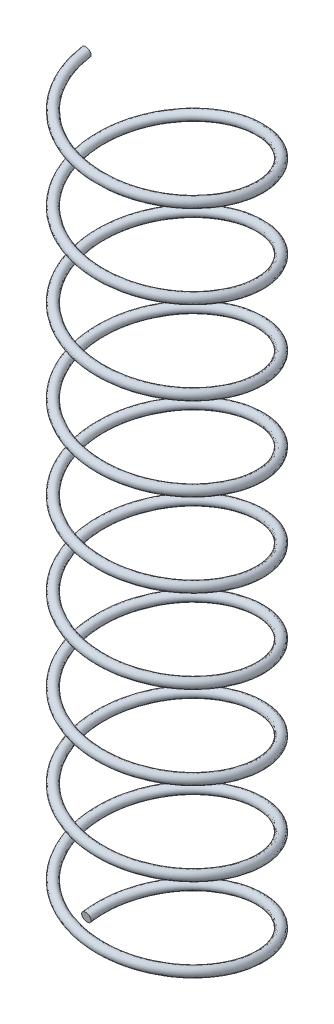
SolidWorks part; units mm, degrees
ref_plane "Face" through (0, 0, 0) normal (0, 0, 1) x (1, 0, 0)
ref_plane "Dessus" through (0, 0, 0) normal (0, 1, 0) x (1, 0, 0)
ref_plane "Droite" through (0, 0, 0) normal (1, 0, 0) x (0, 0, -1)
sketch "Esquisse2" plane through (0, 0, 0) normal (0, 1, 0) x (1, 0, 0)
  circle A0 centre (-1.9759, 0) radius 4.25
curve "Hélice2"
ref_plane "Plan1" through (-6.2259, 40, 0) normal (0, 0.1642, -0.9864) x (-1, 0, 0)
sketch "Esquisse3" plane through (-6.2259, 40, 0) normal (0, 0.1642, -0.9864) x (-1, 0, 0)
  circle A0 centre (0.0548, -0.0305) radius 0.25
sweep "Base-Balayage" add profiles "Esquisse3" path "Hélice2"
